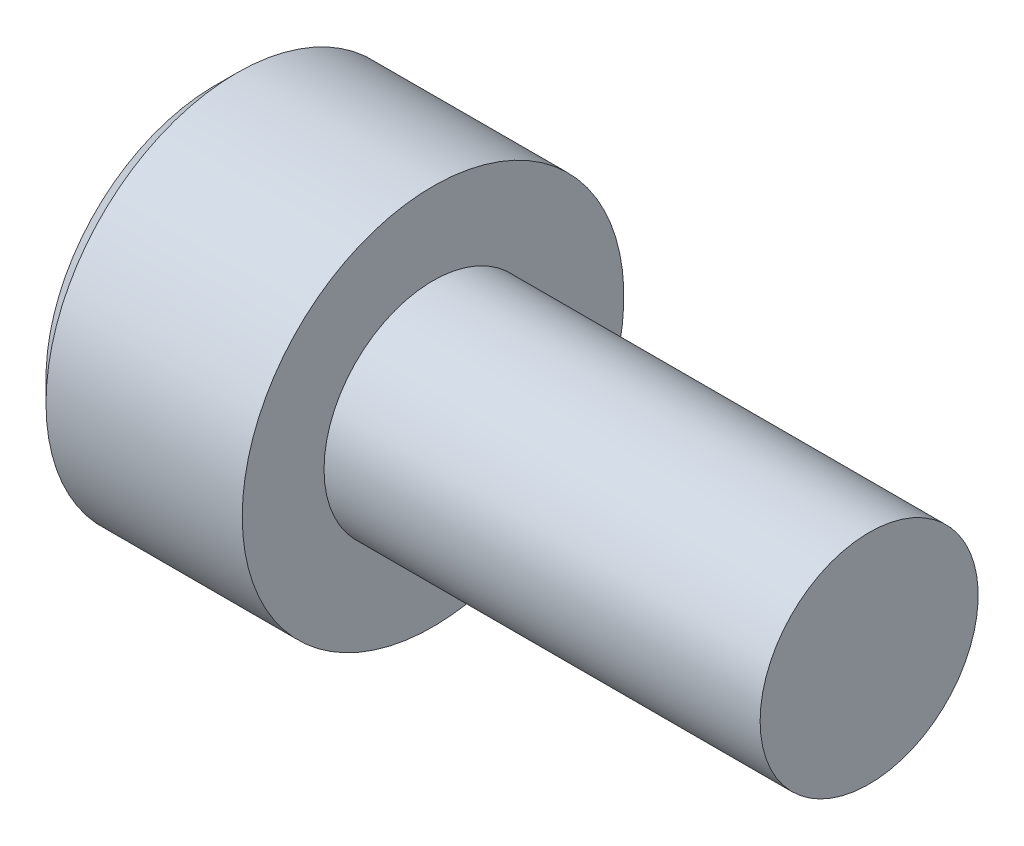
SolidWorks part; units mm, degrees
ref_plane "Front Plane" through (0, 0, 0) normal (0, 0, 1) x (1, 0, 0)
ref_plane "Top Plane" through (0, 0, 0) normal (0, 1, 0) x (1, 0, 0)
ref_plane "Right Plane" through (0, 0, 0) normal (1, 0, 0) x (0, 0, -1)
sketch "Sketch1" plane through (0, 0, 0) normal (0, 0, 1) x (1, 0, 0)
  line L2 (-4, 0) -> (8, 0)
  line L3 (8, 0) -> (8, 2)
  line L4 (8, 2) -> (0, 2)
  line L5 (0, 2) -> (0, 3.5)
  line L6 (0, 3.5) -> (-4, 3.5)
  line L7 (-4, 3.5) -> (-4, 0)
  line L8 (-4, 0) -> (8, 0) construction
  line L9 (0, 0) -> (0, 3.5) construction
  dimension "E" = 4
  dimension "L" = 8
  dimension "A" = 7
  dimension "M" = 4
revolve "Revolve1" add sketch "Sketch1" about L8
chamfer "Chamfer1" distance 0.4 1 edges at (-4, 0, 3.5)
sketch "Sketch2" plane through (0, 0, 0) normal (0, 0, 1) x (1, 0, 0)
  line L0 (-1.0987, 0) -> (-2, 1.5)
  line L1 (-4, 0) -> (8, 0) construction
  line L2 (-2, 1.5) -> (-4, 1.5)
  line L3 (-4, 3.5) -> (-4, 0) construction
  line L4 (-4, 1.5) -> (-4, 0)
  line L5 (-4, 0) -> (-1.0987, 0) construction
  line L6 (-1.0987, 0) -> (-4, 0)
  dimension "FIX_3" = 59
revolve "Cut-Revolve1" cut sketch "Sketch2" about L5
sketch "Sketch3" plane through (-4, 0, 0) normal (-1, 0, 0) x (0, 0, 1)
  line L0 (0, -1.7321) -> (0, 1.7321) construction
  line L1 (0, -1.7321) -> (1.5, -0.866)
  line L2 (1.5, -0.866) -> (1.5, 0.866)
  line L3 (1.5, 0.866) -> (0, 1.7321)
  line L4 (0, 1.7321) -> (-1.5, 0.866)
  line L5 (-1.5, 0.866) -> (-1.5, -0.866)
  line L6 (-1.5, -0.866) -> (0, -1.7321)
  line L7 (-1.5, 0) -> (1.5, 0) construction
  circle A0 centre (0, 0) radius 1.5 construction
extrude "Cut-Extrude1" cut sketch "Sketch3" against normal blind 2
